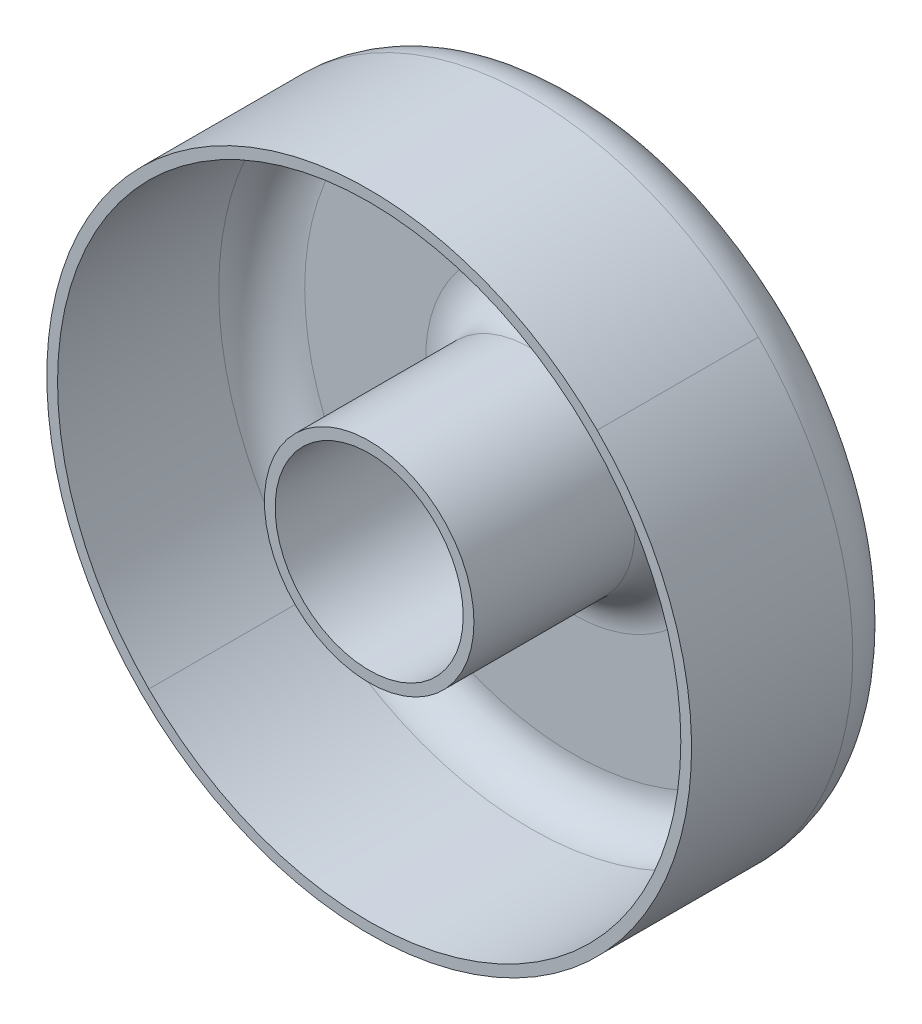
SolidWorks part; units mm, degrees
ref_plane "Front Plane" through (0, 0, 0) normal (0, 0, 1) x (1, 0, 0)
ref_plane "Top Plane" through (0, 0, 0) normal (0, 1, 0) x (1, 0, 0)
ref_plane "Right Plane" through (0, 0, 0) normal (1, 0, 0) x (0, 0, -1)
sketch "Sketch1" plane through (0, 0, 0) normal (0, 0, 1) x (1, 0, 0)
  circle A3 centre (0, 0) radius 60
  dimension "D1" = 120
extrude "Extrude1" add sketch "Sketch1" along normal blind 40
sketch "Sketch2" plane through (0, 0, 40) normal (0, 0, 1) x (1, 0, 0)
  circle A0 centre (0, 0) radius 17.5
  dimension "D1" = 35
extrude "Cut-Extrude1" cut sketch "Sketch2" against normal through all
fillet "Fillet1" radius 10 2 edges at (60, 0, 0) (17.5, 0, 0)
shell "Shell1" thickness 2
ref_plane "Plane1" through (0, 0, 0) normal (0.7071, 0.7071, 0) x (-0.7071, 0.7071, 0)
ref_plane "Plane2" through (0, 0, 0) normal (0.7071, -0.7071, 0) x (0, 0, -1)
sketch "Sketch3" plane through (0, 0, 0) normal (0.7071, 0.7071, 0) x (-0.7071, 0.7071, 0)
  line L0 (0, 40) -> (0, 0)
  line L1 (17.5, 40) -> (-17.5, 40) construction
  line L2 (0, 55.4254) -> (0, -55.4254) construction
  line L3 (-50, 0) -> (50, 0) construction
sketch "Sketch4" plane through (0, 0, 0) normal (0.7071, -0.7071, 0) x (0, 0, -1)
  line L0 (-40.6425, 0) -> (0, 0)
  line L1 (-40, 0) -> (-10, 0) construction
sketch "Sketch5" plane through (0, 0, 0) normal (0, 1, 0) x (1, 0, 0)
  line L0 (0, 0) -> (0, -40)
  line L1 (-42.4264, -40) -> (42.4264, -40) construction
extrude "symmetry" [suppressed] cut sketch "Sketch5" against normal through all and the other way through all
